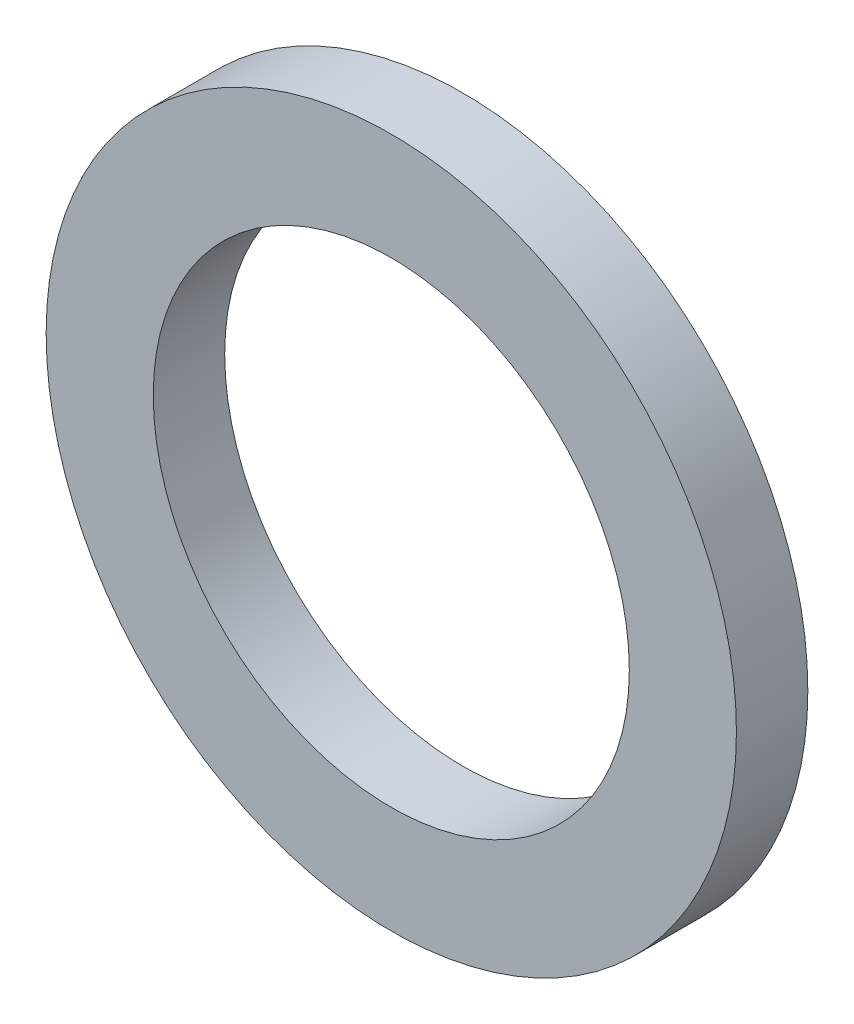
SolidWorks part; units mm, degrees
ref_plane "Plan1" through (0, 0, 0) normal (0, 0, 1) x (1, 0, 0)
ref_plane "Plan2" through (0, 0, 0) normal (0, 1, 0) x (1, 0, 0)
ref_plane "Plan3" through (0, 0, 0) normal (1, 0, 0) x (0, 0, -1)
sketch "Esquisse1" plane through (0, 0, 0) normal (0, 0, 1) x (1, 0, 0)
  circle A0 centre (0, 0) radius 5
  circle A1 centre (0, 0) radius 7.25
  dimension "D1" = 10
  dimension "D2" = 14.5
extrude "Base-Extrusion" add sketch "Esquisse1" along normal blind 1.5
